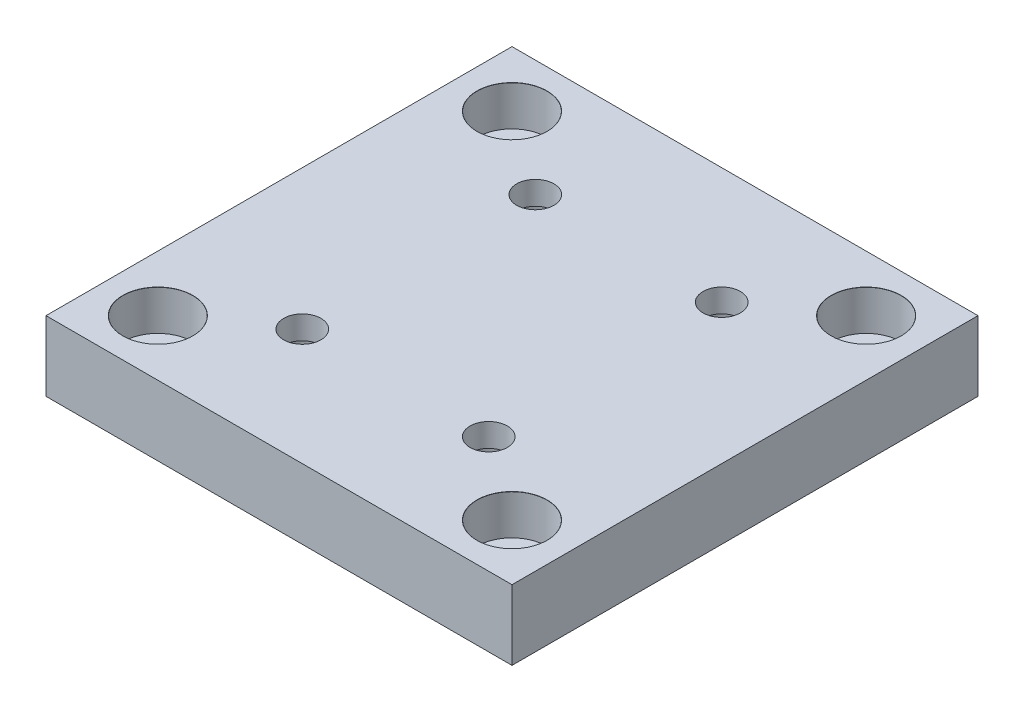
SolidWorks part; units mm, degrees
ref_plane "Front Plane" through (0, 0, 0) normal (0, 0, 1) x (1, 0, 0)
ref_plane "Top Plane" through (0, 0, 0) normal (0, 1, 0) x (1, 0, 0)
ref_plane "Right Plane" through (0, 0, 0) normal (1, 0, 0) x (0, 0, -1)
sketch "Sketch1" plane through (0, 0, 0) normal (0, 1, 0) x (1, 0, 0)
  line L1 (-50, -50) -> (50, -50)
  line L2 (-50, -50) -> (-50, 50)
  line L3 (-50, 50) -> (50, 50)
  line L4 (50, -50) -> (50, 50)
  line L5 (-50, -50) -> (50, 50) construction
  line L6 (-50, 50) -> (50, -50) construction
  line L11 (-30, 35) -> (30, -35) construction
  line L12 (-30, -35) -> (30, 35) construction
  point P0 (0, 0)
  point P6 (0, 0)
  dimension "D1" = 100
  dimension "D2" = 100
  dimension "D3" = 70
  dimension "D4" = 60
extrude "Boss-Extrude1" add sketch "Sketch1" along normal blind 15
sketch "Sketch2" plane through (0, 0, 0) normal (0, -1, 0) x (-1, 0, 0)
  line L0 (-18.3179, -21.3709) -> (-30, -35) construction
  line L1 (-18.3179, 21.3709) -> (-30, 35) construction
  line L5 (30, 35) -> (18.3179, 21.3709) construction
  line L6 (30, -35) -> (18.3179, -21.3709) construction
  circle A0 centre (20, -25) radius 4
  circle A1 centre (20, 25) radius 4
  circle A2 centre (-20, 25) radius 4
  circle A3 centre (-20, -25) radius 4
  point P0 (0, 0)
  dimension "D11" = 8
  dimension "D1" = 60
  dimension "D2" = 70
extrude "Cut-Extrude2" cut sketch "Sketch2" against normal blind 15
sketch "Sketch3" plane through (0, 0, 0) normal (0, -1, 0) x (1, 0, 0)
  circle A0 centre (-20, 25) radius 6.25
  circle A1 centre (-20, -25) radius 6.25
  circle A2 centre (20, -25) radius 6.25
  circle A3 centre (20, 25) radius 6.25
  dimension "D1" = 12.5
extrude "Cut-Extrude3" cut sketch "Sketch3" against normal blind 10
hole_wizard "CBORE for M8 Hex Socket Head Cap Screw1" positions "3DSketch1" profile "Sketch5" counterbore size "M8" standard "ISO"
sketch3d "3DSketch1"
  line L0 (-50, 15, -50) -> (-50, 15, 50) construction
  line L1 (50, 15, -50) -> (-50, 15, -50) construction
  line L2 (-50, 15, 50) -> (50, 15, 50) construction
  line L3 (50, 15, 50) -> (50, 15, -50) construction
  point P0 (-38, 15, -38)
  point P2 (-38, 15, 38)
  point P4 (38, 15, 38)
  point P6 (38, 15, -38)
  point P17 (0, 0, 0)
  point P18 (0, 0, 0)
  point P19 (0, 0, 0)
  point P20 (0, 0, 0)
  dimension "D1" = 12
  dimension "D2" = 12
  dimension "D3" = 12
  dimension "D4" = 12
sketch "Sketch5" plane through (-38, 15, -38) normal (1, 0, 0) x (0, 0, 1)
  line L0 (0, 0) -> (0, 15)
  line L1 (0, 15) -> (4.5, 15)
  line L3 (4.5, 15) -> (4.5, 8.6)
  line L4 (7.5, 8.6) -> (4.5, 8.6)
  line L5 (7.5, 8.6) -> (7.5, 0.025)
  line L6 (7.5, 0.025) -> (7.525, 0)
  line L7 (7.525, 0) -> (0, 0)
  line L8 (-7.5, 0.025) -> (-7.525, 0) construction
  line L11 (0, -6.35) -> (0, 107.95) construction
  dimension "Thru Hole Dia." = 9
  dimension "Thru Hole Depth" = 15
  dimension "C'Bore Dia." = 15
  dimension "C'Bore Depth" = 8.6
  dimension "Near C'Sink Dia." = 15.05
  dimension "Near C'Sink Angle" = 90
